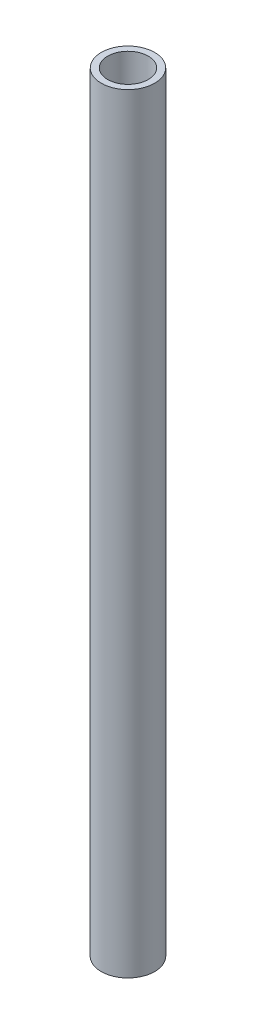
SolidWorks part; units mm, degrees
ref_plane "Front Plane" through (0, 0, 0) normal (0, 0, 1) x (1, 0, 0)
ref_plane "Top Plane" through (0, 0, 0) normal (0, 1, 0) x (1, 0, 0)
ref_plane "Right Plane" through (0, 0, 0) normal (1, 0, 0) x (0, 0, -1)
sketch "Esquisse1" plane through (0, 0, 0) normal (0, 1, 0) x (1, 0, 0)
  circle A0 centre (0, 0) radius 12.5
  circle A1 centre (0, 0) radius 9.5
  dimension "D1" = 25
  dimension "D2" = 3
extrude "Boss.-Extru.1" add sketch "Esquisse1" against normal blind 360
